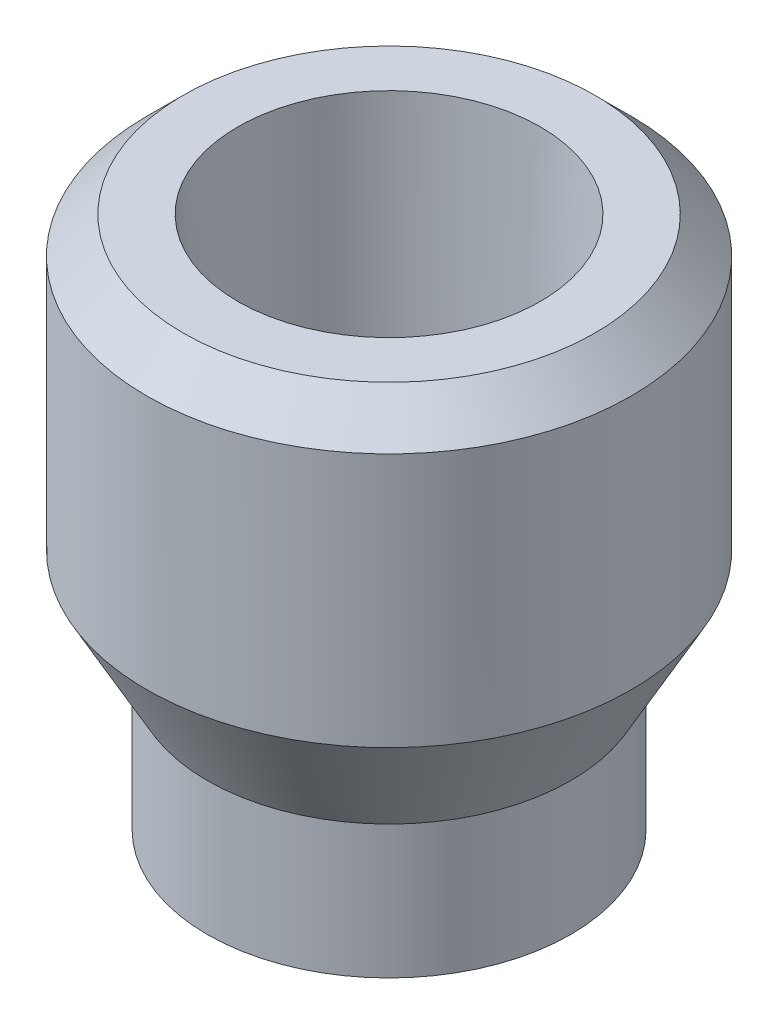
SolidWorks part; units mm, degrees
ref_plane "Přední rovina" through (0, 0, 0) normal (0, 0, 1) x (1, 0, 0)
ref_plane "Horní rovina" through (0, 0, 0) normal (0, 1, 0) x (1, 0, 0)
ref_plane "Pravá rovina" through (0, 0, 0) normal (1, 0, 0) x (0, 0, -1)
sketch "Skica1" plane through (0, 0, 0) normal (0, 1, 0) x (1, 0, 0)
  circle A0 centre (0, 0) radius 10
  dimension "D1" = 20
extrude "Přidat vysunutím1" add sketch "Skica1" along normal blind 22
sketch "Skica2" plane through (0, 0, 0) normal (0, -1, 0) x (1, 0, 0)
  circle A0 centre (0, 0) radius 7.5
  dimension "D1" = 15
extrude "Odebrat vysunutím1" cut sketch "Skica2" against normal blind 10 flip side to cut
chamfer "Zkosení1" distance 2.5 distance2 4.5 1 edges at (0, 10, -7.5)
chamfer "Zkosení2" distance 1.5 angle 45 1 edges at (0, 22, 10)
sketch "Skica5" plane through (0, 0, 0) normal (0, -1, 0) x (1, 0, 0)
  circle A0 centre (0, 0) radius 3.5
  dimension "D1" = 7
extrude "Odebrat vysunutím2" cut sketch "Skica5" against normal through all
hole_wizard "1/4 sérii závitu2" positions "Skica7" profile "Skica6" size "1/4" standard "ANSI palce"
sketch "Skica7" plane through (0, 22, 0) normal (0, 1, 0) x (-1, 0, 0)
  circle A1 centre (0, 0) radius 8.5 construction
  point P0 (0, 0)
  dimension "D1" = 0
sketch "Skica6" plane through (0, 22, 0) normal (1, 0, 0) x (0, 0, 1)
  line L0 (0, 0) -> (0, 17.2116)
  line L1 (5.5626, 14) -> (0, 17.2116)
  line L2 (-5.5626, 14) -> (0, 17.2116) construction
  line L3 (5.5626, 14) -> (5.5626, 10.02)
  line L4 (5.5626, 10.02) -> (5.9437, 10.02)
  line L5 (5.9437, 10.02) -> (6.2437, 0)
  line L6 (-5.9437, 10.02) -> (-6.2437, 0) construction
  line L7 (6.2437, 0) -> (0, 0)
  line L8 (0, -6.35) -> (0, 107.95) construction
  line L11 (-5.5626, 10.02) -> (-5.9437, 10.02) construction
  dimension "Průměr závitníku" = 11.1252
  dimension "Hloubka závitníku" = 14
  dimension "Průměr závitu" = 12.4874
  dimension "Úhel závitu" = 3.43
  dimension "Hloubka závitu" = 10.02
  dimension "Úhel vrtání" = 120
